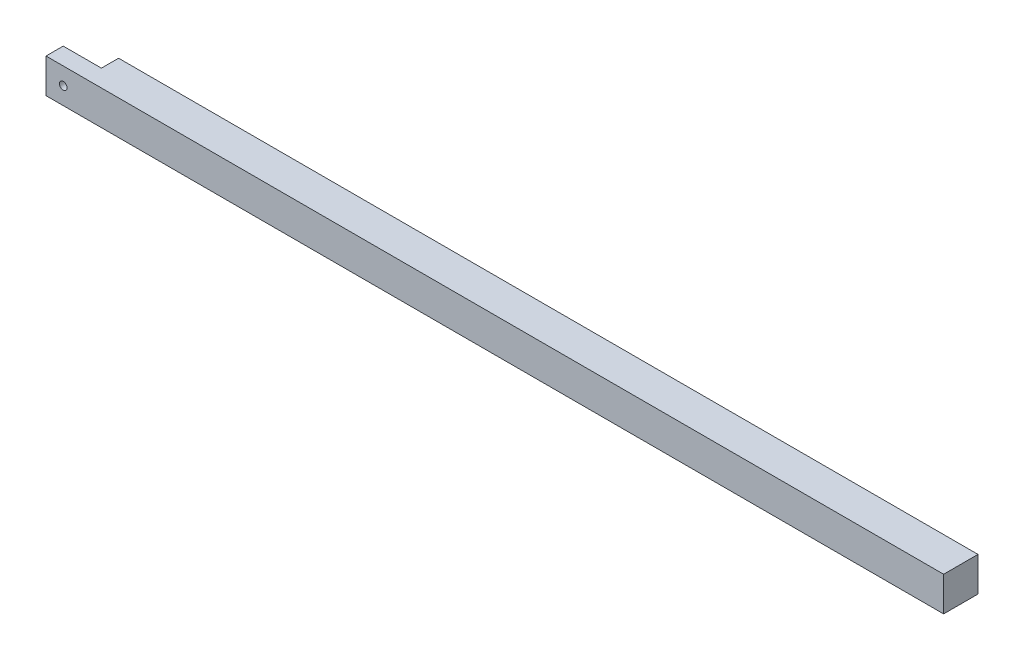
SolidWorks part; units mm, degrees
ref_plane "Plan de face" through (0, 0, 0) normal (0, 0, 1) x (1, 0, 0)
ref_plane "Plan de dessus" through (0, 0, 0) normal (0, 1, 0) x (1, 0, 0)
ref_plane "Plan de droite" through (0, 0, 0) normal (1, 0, 0) x (0, 0, -1)
sketch "Esquisse1" plane through (0, 0, 0) normal (0, 0, 1) x (1, 0, 0)
  line L1 (0, 0) -> (235, 0)
  line L2 (0, 0) -> (0, 9)
  line L3 (0, 9) -> (235, 9)
  line L4 (235, 0) -> (235, 9)
  dimension "D1" = 235
  dimension "D2" = 9
extrude "Extrusion1" add sketch "Esquisse1" along normal blind 9
sketch "Esquisse2" plane through (0, 0, 0) normal (0, 0, -1) x (-1, 0, 0)
  line L0 (-235, 9) -> (0, 9) construction
  line L1 (0, 0) -> (-10, 0)
  line L2 (0, 0) -> (0, 9)
  line L3 (0, 9) -> (-10, 9)
  line L4 (-10, 0) -> (-10, 9)
  dimension "D1" = 10
extrude "Enlèv. mat.-Extru.1" cut sketch "Esquisse2" against normal blind 4.5
sketch "Esquisse3" plane through (0, 0, 9) normal (0, 0, 1) x (1, 0, 0)
  line L0 (0, 9) -> (0, 0) construction
  line L1 (0, 0) -> (235, 0) construction
  circle A0 centre (4.5, 4.5) radius 1
  dimension "D3" = 2
  dimension "D1" = 4.5
  dimension "D2" = 4.5
extrude "Enlèv. mat.-Extru.2" cut sketch "Esquisse3" against normal blind 4.5
